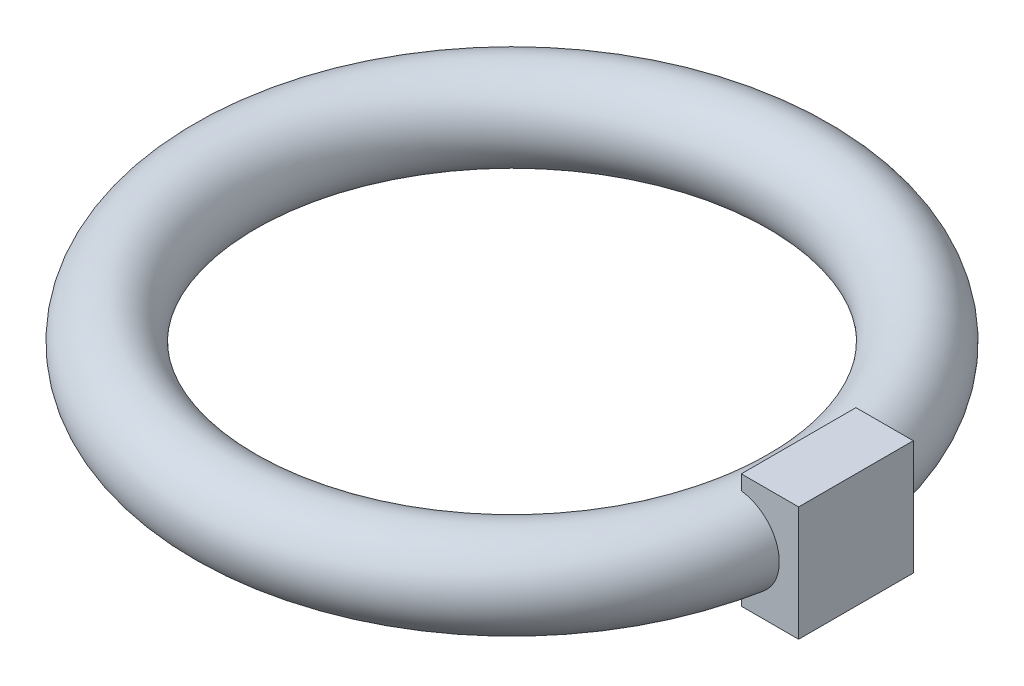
SolidWorks part; units mm, degrees
ref_plane "Plane1" through (0, 0, 0) normal (0, 0, 1) x (1, 0, 0)
ref_plane "Plane2" through (0, 0, 0) normal (0, 1, 0) x (1, 0, 0)
ref_plane "Plane3" through (0, 0, 0) normal (1, 0, 0) x (0, 0, -1)
sketch "Sketch1" plane through (0, 0, 0) normal (0, 0, 1) x (1, 0, 0)
  circle A0 centre (0, 0) radius 7.5
  dimension "D1" = 15
sketch "Sketch2" plane through (0, 0, 0) normal (0, 1, 0) x (1, 0, 0)
  circle A0 centre (50, 0) radius 40
  dimension "D1" = 80
  dimension "D2" = 50
sweep "Base-Sweep" add profiles "Sketch1" path "Sketch2"
ref_plane "Plane4" through (-50, 0, 0) normal (1, 0, 0) x (0, 0, -1)
ref_plane "Plane6" through (110, 0, 0) normal (1, 0, 0) x (0, 0, -1)
sketch "Sketch4" plane through (110, 0, 0) normal (1, 0, 0) x (0, 0, -1)
  line L1 (10, 10) -> (-10, 10)
  line L2 (10, 10) -> (10, -10)
  line L3 (10, -10) -> (-10, -10)
  line L4 (-10, 10) -> (-10, -10)
  dimension "D1" = 20
  dimension "D2" = 20
extrude "Boss-Extrude1" add sketch "Sketch4" against normal blind 10
